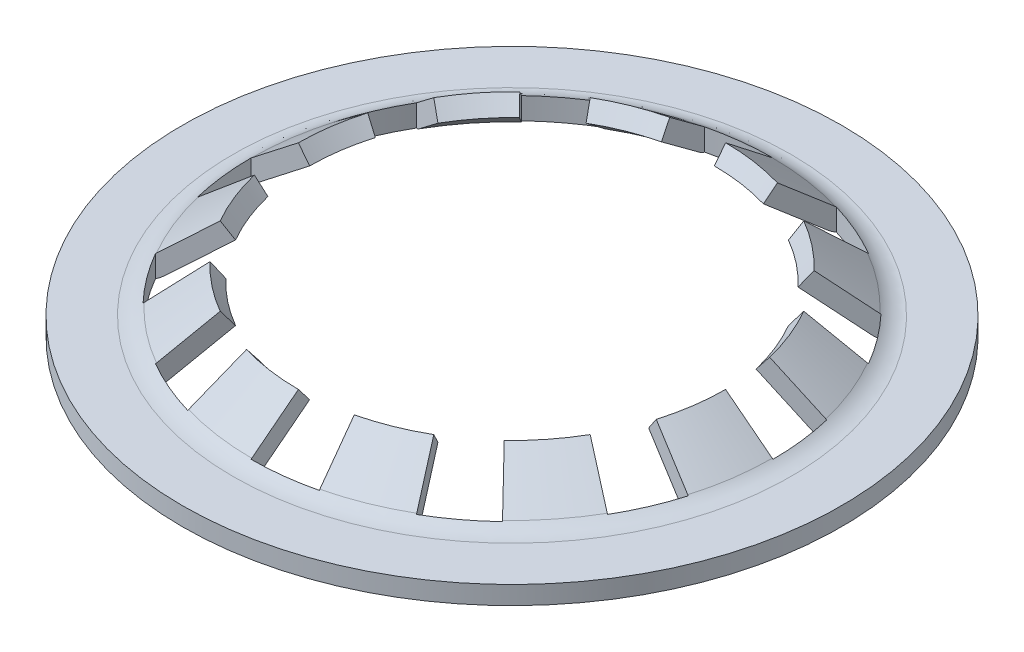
SolidWorks part; units mm, degrees
ref_plane "Face" through (0, 0, 0) normal (0, 0, 1) x (1, 0, 0)
ref_plane "Dessus" through (0, 0, 0) normal (0, 1, 0) x (1, 0, 0)
ref_plane "Droite" through (0, 0, 0) normal (1, 0, 0) x (0, 0, -1)
sketch "Esquisse1" plane through (0, 0, 0) normal (0, 0, 1) x (1, 0, 0)
  line L0 (0, 8.7343) -> (0, -9.2287) construction
  line L1 (4.4686, 0) -> (5.4, 0)
  line L2 (5.4, 0) -> (5.4, 0.3)
  line L3 (5.4, 0.3) -> (4.5716, 0.3)
  line L4 (4.2646, 0.4053) -> (3.5, 1)
  line L5 (3.5, 1) -> (3.3158, 0.7632)
  line L6 (3.3158, 0.7632) -> (4.1617, 0.1053)
  arc A1 (4.2646, 0.4053) -> (4.5716, 0.3) centre (4.5716, 0.8) ccw
  arc A2 (4.4686, 0) -> (4.1617, 0.1053) centre (4.4686, 0.5) cw
  point P11 (8.3786, -0.6107)
  point P14 (4.4, 0.3)
  dimension "D1" = 5.4
  dimension "D8" = 0.5
  dimension "D9" = 0.5
  dimension "D3" = 0.3
  dimension "D4" = 1
  dimension "D5" = 1
  dimension "D6" = 3.5
  dimension "D7" = 0.3
revolve "Base-Révolution" add sketch "Esquisse1" angle 360 about L0
sketch "Esquisse2" plane through (0, 0, 0) normal (0, -1, 0) x (1, 0, 0)
  line L0 (-1, -4.1577) -> (-0.7416, -3.0832)
  line L1 (0, -3.1712) -> (0, -4.2763)
  line L2 (-2.9449, -3.1007) -> (-2.1838, -2.2994)
  line L3 (-1.5856, -2.7463) -> (-2.1382, -3.7034)
  line L4 (1.5856, -2.7463) -> (2.1382, -3.7034)
  line L5 (-4.1007, -1.2128) -> (-3.0409, -0.8994)
  line L6 (-2.7463, -1.5856) -> (-3.7034, -2.1382)
  line L7 (-4.1577, 1) -> (-3.0832, 0.7416)
  line L8 (-3.1712, 0) -> (-4.2763, 0)
  line L9 (-3.1007, 2.9449) -> (-2.2994, 2.1838)
  line L10 (-2.7463, 1.5856) -> (-3.7034, 2.1382)
  line L11 (-1.2128, 4.1007) -> (-0.8994, 3.0409)
  line L12 (-1.5856, 2.7463) -> (-2.1382, 3.7034)
  line L13 (1, 4.1577) -> (0.7416, 3.0832)
  line L14 (0, 3.1712) -> (0, 4.2763)
  line L15 (2.9449, 3.1007) -> (2.1838, 2.2994)
  line L16 (1.5856, 2.7463) -> (2.1382, 3.7034)
  line L17 (4.1007, 1.2128) -> (3.0409, 0.8994)
  line L18 (2.7463, 1.5856) -> (3.7034, 2.1382)
  line L19 (4.1577, -1) -> (3.0832, -0.7416)
  line L20 (3.1712, 0) -> (4.2763, 0)
  line L21 (3.1007, -2.9449) -> (2.2994, -2.1838)
  line L22 (2.7463, -1.5856) -> (3.7034, -2.1382)
  line L24 (1.2128, -4.1007) -> (0.8994, -3.0409)
  arc A0 (0, -3.1712) -> (0.8994, -3.0409) centre (0, 0) ccw
  arc A1 (-1.5856, -2.7463) -> (-0.7416, -3.0832) centre (0, 0) ccw
  arc A2 (-1, -4.1577) -> (0, -4.2763) centre (0, 0) ccw
  arc A3 (-2.7463, -1.5856) -> (-2.1838, -2.2994) centre (0, 0) ccw
  arc A4 (1.2128, -4.1007) -> (2.1382, -3.7034) centre (0, 0) ccw
  arc A5 (-2.9449, -3.1007) -> (-2.1382, -3.7034) centre (0, 0) ccw
  arc A6 (-3.1712, 0) -> (-3.0409, -0.8994) centre (0, 0) ccw
  arc A7 (-4.1007, -1.2128) -> (-3.7034, -2.1382) centre (0, 0) ccw
  arc A8 (-2.7463, 1.5856) -> (-3.0832, 0.7416) centre (0, 0) ccw
  arc A9 (-4.1577, 1) -> (-4.2763, 0) centre (0, 0) ccw
  arc A10 (-1.5856, 2.7463) -> (-2.2994, 2.1838) centre (0, 0) ccw
  arc A11 (-3.1007, 2.9449) -> (-3.7034, 2.1382) centre (0, 0) ccw
  arc A12 (0, 3.1712) -> (-0.8994, 3.0409) centre (0, 0) ccw
  arc A13 (-1.2128, 4.1007) -> (-2.1382, 3.7034) centre (0, 0) ccw
  arc A14 (1.5856, 2.7463) -> (0.7416, 3.0832) centre (0, 0) ccw
  arc A15 (1, 4.1577) -> (0, 4.2763) centre (0, 0) ccw
  arc A16 (2.7463, 1.5856) -> (2.1838, 2.2994) centre (0, 0) ccw
  arc A17 (2.9449, 3.1007) -> (2.1382, 3.7034) centre (0, 0) ccw
  arc A18 (3.1712, 0) -> (3.0409, 0.8994) centre (0, 0) ccw
  arc A19 (4.1007, 1.2128) -> (3.7034, 2.1382) centre (0, 0) ccw
  arc A20 (2.7463, -1.5856) -> (3.0832, -0.7416) centre (0, 0) ccw
  arc A21 (4.1577, -1) -> (4.2763, 0) centre (0, 0) ccw
  arc A22 (1.5856, -2.7463) -> (2.2994, -2.1838) centre (0, 0) ccw
  arc A23 (3.1007, -2.9449) -> (3.7034, -2.1382) centre (0, 0) ccw
extrude "Enlèv. mat.-Extru.1" cut sketch "Esquisse2" against normal through all
